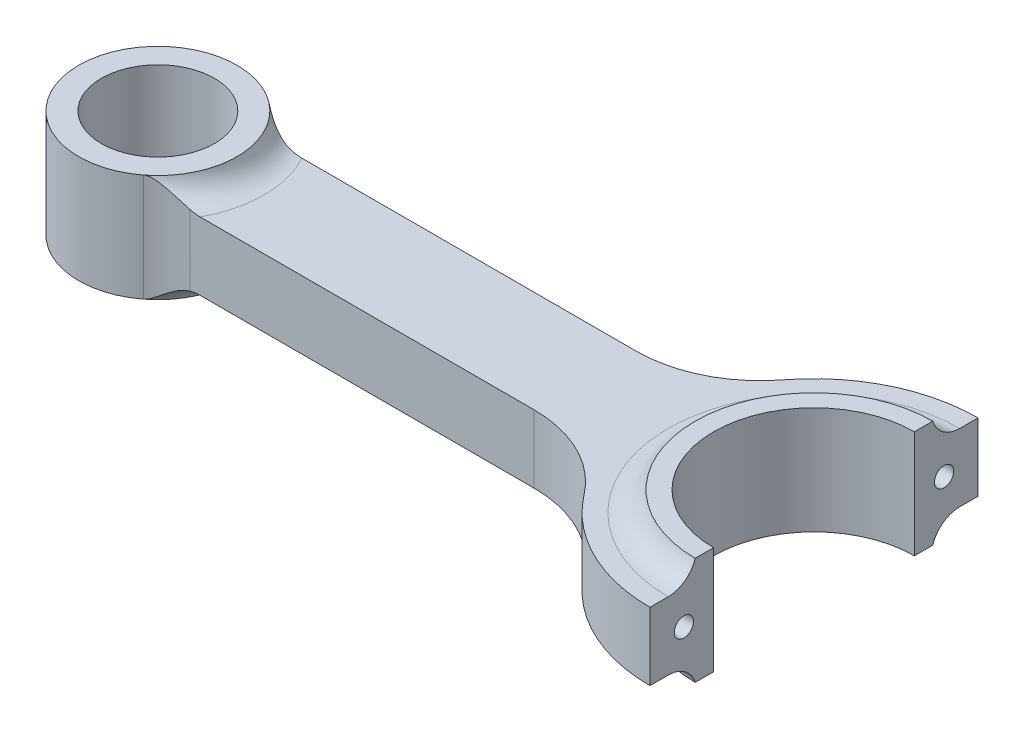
SolidWorks part; units mm, degrees
ref_plane "Front Plane" through (0, 0, 0) normal (0, 0, 1) x (1, 0, 0)
ref_plane "Top Plane" through (0, 0, 0) normal (0, 1, 0) x (1, 0, 0)
ref_plane "Right Plane" through (0, 0, 0) normal (1, 0, 0) x (0, 0, -1)
imported_body "Stock-Connecting Rod-1"
hole_wizard "CBORE for M3 Pan Head Machine Screw1" positions "Sketch1" profile "Sketch2" counterbore size "M3" standard "ANSI Metric"
sketch "Sketch1" plane through (20, 0, 0) normal (1, 0, 0) x (0, 0, -1)
  point P0 (-23, 0)
  point P2 (23, 0)
  point P6 (-23, 0)
sketch "Sketch2" plane through (20, 0, 23) normal (0, 1, 0) x (0, 0, -1)
  line L0 (0, 0) -> (0, 31.0215)
  line L1 (0, 31.0215) -> (1.7, 30)
  line L2 (1.7, 30) -> (1.7, 2.4)
  line L3 (1.7, 2.4) -> (3.5, 2.4)
  line L4 (3.5, 2.4) -> (3.5, 0)
  line L5 (3.5, 0) -> (0, 0)
  line L6 (0, 31.0215) -> (-1.7, 30) construction
  line L7 (0, -6.35) -> (0, 107.95) construction
  dimension "Hole Dia." = 3.4
  dimension "Hole Depth" = 30
  dimension "C'Bore Dia." = 7
  dimension "C'Bore Depth" = 2.4
  dimension "Drill Angle" = 118
